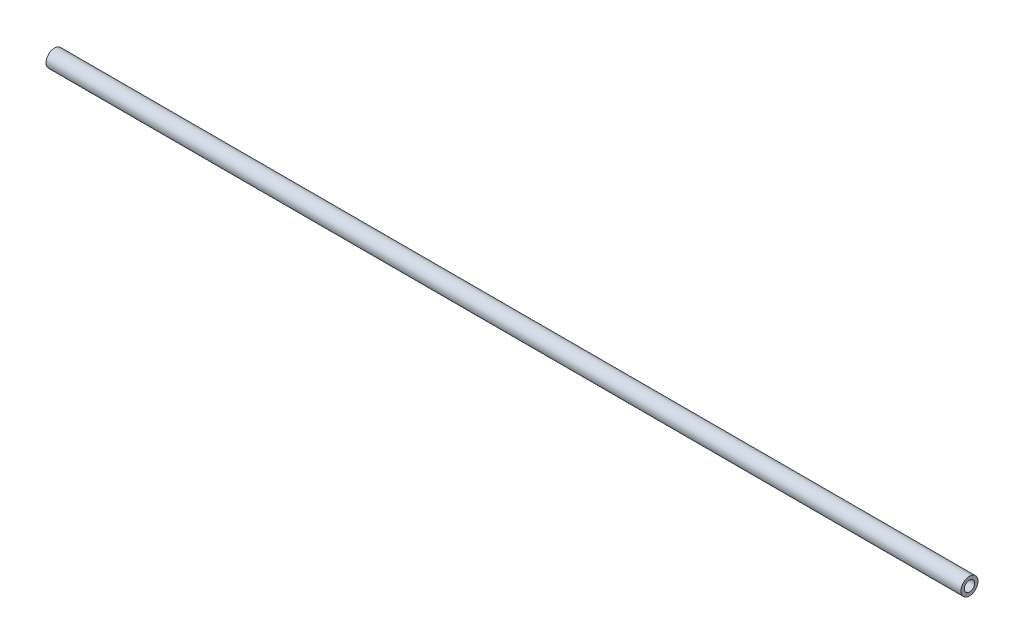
SolidWorks part; units mm, degrees
ref_plane "Front" through (0, 0, 0) normal (0, 0, 1) x (1, 0, 0)
ref_plane "Top" through (0, 0, 0) normal (0, 1, 0) x (1, 0, 0)
ref_plane "Right" through (0, 0, 0) normal (1, 0, 0) x (0, 0, -1)
sketch "Sketch1" plane through (0, 0, 0) normal (0, 0, 1) x (1, 0, 0)
  line L0 (0, 0) -> (41.9184, 0) construction
  line L1 (-533.4, 3.9687) -> (0, 3.9687)
  line L2 (0, 2.3812) -> (-533.4, 2.3812)
  line L3 (0, -2.3812) -> (-533.4, -2.3812) construction
  line L4 (-533.4, -3.9687) -> (0, -3.9687) construction
  line L6 (-533.4, 2.3812) -> (-533.4, 3.9687)
  line L7 (0, 3.9687) -> (0, 2.3812)
  dimension "D1" = 7.9375
  dimension "D3" = 1.5875
  dimension "D4" = 4.7625
  dimension "D5" = 533.4
revolve "Revolve1" add sketch "Sketch1" angle 360 about L0
sketch "Sketch2" plane through (0, 0, 0) normal (0, 0, 1) x (1, 0, 0)
  line L1 (-425.45, 75.6637) -> (-659.2587, 75.6637)
  line L2 (-425.45, 75.6637) -> (-425.45, -59.4982)
  line L3 (-425.45, -59.4982) -> (-659.2587, -59.4982)
  line L4 (-659.2587, 75.6637) -> (-659.2587, -59.4982)
  dimension "D1" = 425.45
extrude "Extrude1" cut sketch "Sketch2" against normal mid plane 10.3187
